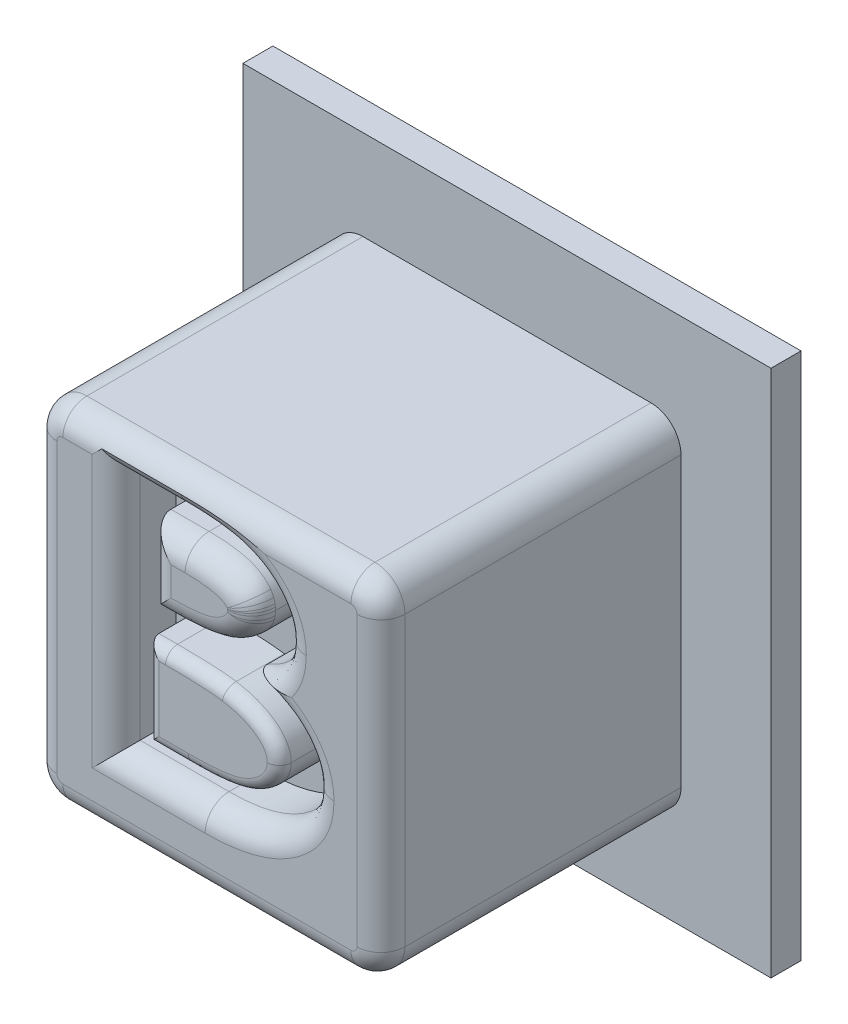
SolidWorks part; units mm, degrees
ref_plane "Plan de face" through (0, 0, 0) normal (0, 0, 1) x (1, 0, 0)
ref_plane "Plan de dessus" through (0, 0, 0) normal (0, 1, 0) x (1, 0, 0)
ref_plane "Plan de droite" through (0, 0, 0) normal (1, 0, 0) x (0, 0, -1)
sketch "Esquisse1" plane through (0, 0, 0) normal (0, 0, 1) x (1, 0, 0)
  line L1 (-2.9, 2.9) -> (2.9, 2.9)
  line L2 (-2.9, 2.9) -> (-2.9, -2.9)
  line L3 (-2.9, -2.9) -> (2.9, -2.9)
  line L4 (2.9, 2.9) -> (2.9, -2.9)
  line L5 (-2.9, 2.9) -> (2.9, -2.9) construction
  line L6 (-2.9, -2.9) -> (2.9, 2.9) construction
  point P0 (0, 0)
  dimension "D1" = 5.8
  dimension "D2" = 5.8
extrude "Boss.-Extru.1" add sketch "Esquisse1" along normal blind 5
sketch "Esquisse2" plane through (0, 0, 0) normal (0, 0, -1) x (-1, 0, 0)
  line L8 (-4.4, 4.4) -> (-4.4, -4.4)
  line L9 (-4.4, -4.4) -> (4.4, -4.4)
  line L10 (4.4, -4.4) -> (4.4, 4.4)
  line L11 (4.4, 4.4) -> (-4.4, 4.4)
  line L12 (-4.4, 4.4) -> (-4.4, -4.4)
  line L13 (-4.4, -4.4) -> (4.4, -4.4)
  line L14 (4.4, -4.4) -> (4.4, 4.4)
  line L15 (4.4, 4.4) -> (-4.4, 4.4)
  dimension "D1" = 1.5
extrude "Boss.-Extru.2" add sketch "Esquisse2" along normal blind 1
chamfer "Chanfrein1" distance 0.5 angle 45 4 edges at (0, -4.4, -1) (-4.4, 0, -1) (0, 4.4, -1) (4.4, 0, -1)
sketch "Esquisse3" plane through (0, 0, 5) normal (0, 0, 1) x (1, 0, 0)
  line L0 (-2.9, -1.6255) -> (2.9, -1.6255) construction
  line L1 (-2.9, 2.9) -> (-2.9, -2.9) construction
  line L2 (2.9, -2.9) -> (2.9, 2.9) construction
  text T0 "B" font "Century Gothic" height 4
extrude "Enlèv. mat.-Extru.1" cut sketch "Esquisse3" against normal blind 1
fillet "Congé2" radius 0.4 11 edges at (-0.772, -1.6255, 5) (-0.986, 2.3745, 5) (-1.5128, 0.3745, 5) (0, -2.9, 5) (-2.9, 0, 5) (0, 2.9, 5) (2.9, 0, 5)
fillet "Congé4" radius 0.5 8 edges at (-2.7828, -2.7828, 4.8828) (2.7828, -2.7828, 4.8828) (2.7828, 2.7828, 4.8828) (-2.7828, 2.7828, 4.8828) (-2.9, -2.9, 2.3) (2.9, -2.9, 2.3) (2.9, 2.9, 2.3) (-2.9, 2.9, 2.3)
fillet "Congé5" radius 0.4 4 edges at (-1, 1.3232, 5) (-0.6811, 1.9642, 5)
fillet "Congé7" radius 0.2 6 edges at (-0.6563, -1.2153, 5) (-0.8446, 0.2719, 5) (-1, -0.4717, 5)
